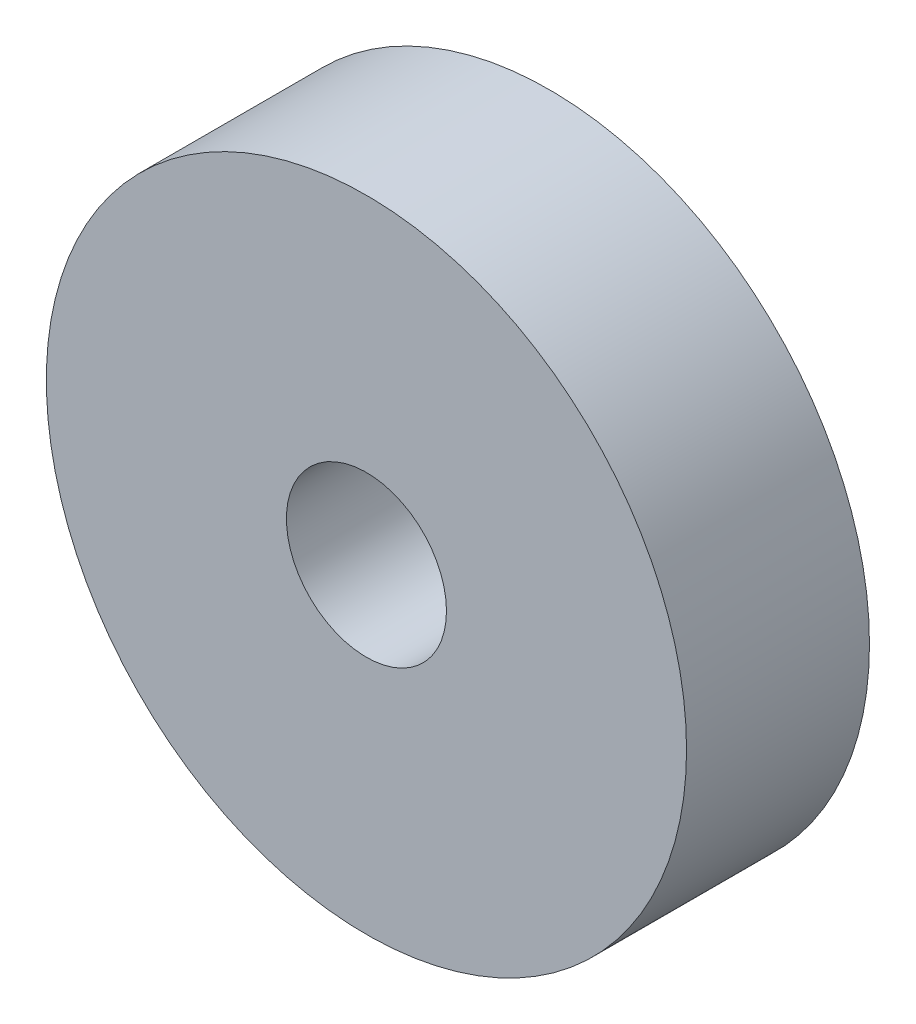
SolidWorks part; units mm, degrees
ref_plane "Front Plane" through (0, 0, 0) normal (0, 0, 1) x (1, 0, 0)
ref_plane "Top Plane" through (0, 0, 0) normal (0, 1, 0) x (1, 0, 0)
ref_plane "Right Plane" through (0, 0, 0) normal (1, 0, 0) x (0, 0, -1)
sketch "Sketch1" plane through (0, 0, 0) normal (0, 0, 1) x (1, 0, 0)
  circle A0 centre (0, 0) radius 7
  circle A1 centre (0, 0) radius 1.75
  dimension "D1" = 3.5
  dimension "D2" = 14
extrude "Extrude1" add sketch "Sketch1" along normal blind 4
